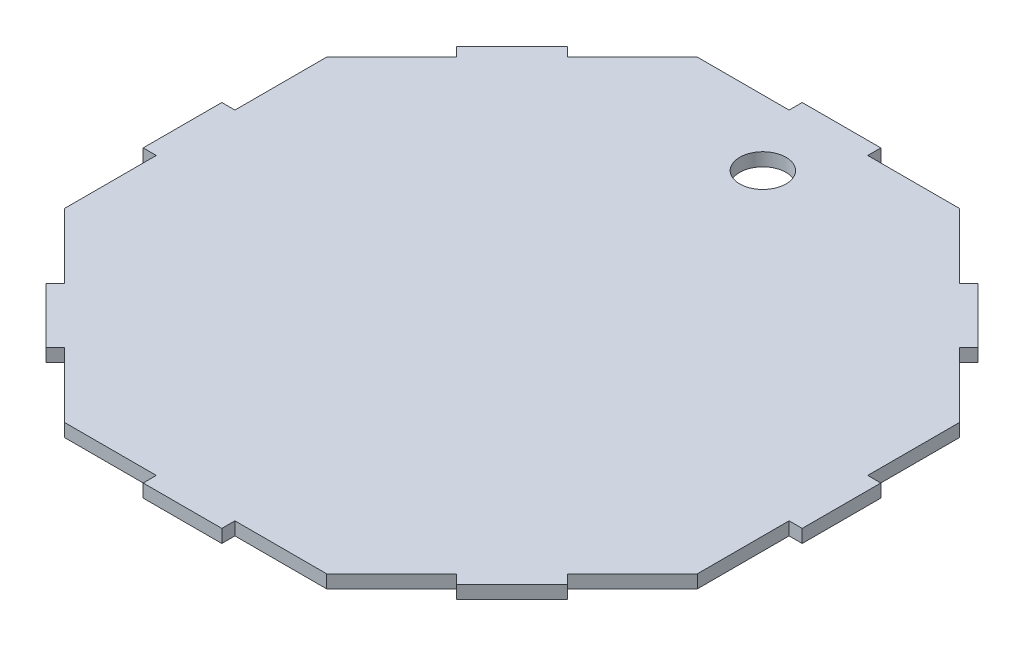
SolidWorks part; units mm, degrees
ref_plane "Alzado" through (0, 0, 0) normal (0, 0, 1) x (1, 0, 0)
ref_plane "Planta" through (0, 0, 0) normal (0, 1, 0) x (1, 0, 0)
ref_plane "Vista lateral" through (0, 0, 0) normal (1, 0, 0) x (0, 0, -1)
sketch "Croquis1" plane through (0, 0, 0) normal (0, 1, 0) x (1, 0, 0)
  line L0 (-30.909, -85.6617) -> (-30.909, -50.6617)
  line L1 (-30.909, 14.3383) -> (-6.1602, 39.087)
  line L2 (39.8017, 85.049) -> (74.8017, 85.049)
  line L3 (139.8017, 85.049) -> (164.5504, 60.3002)
  line L4 (210.5124, 14.3383) -> (210.5124, -20.6617)
  line L5 (210.5124, -85.6617) -> (185.7636, -110.4105)
  line L6 (139.8017, -156.3724) -> (104.8017, -156.3724)
  line L7 (39.8017, -156.3724) -> (15.053, -131.6237)
  line L8 (320.5164, -110.9064) -> (350.5164, -110.9064)
  line L9 (285.5164, -130.9064) -> (385.5164, -130.9064)
  line L10 (285.5164, -130.9064) -> (285.5164, -10.9064)
  line L11 (285.5164, -10.9064) -> (385.5164, -10.9064)
  line L12 (385.5164, -130.9064) -> (385.5164, -10.9064)
  line L13 (350.5164, -110.9064) -> (350.5164, -105.9064)
  line L14 (350.5164, -105.9064) -> (320.5164, -105.9064)
  line L15 (320.5164, -105.9064) -> (320.5164, -110.9064)
  line L16 (-35.909, -50.6617) -> (-35.909, -20.6617)
  line L17 (320.5164, -35.9064) -> (320.5164, -30.9064)
  line L18 (350.5164, -35.9064) -> (320.5164, -35.9064)
  line L19 (350.5164, -30.9064) -> (350.5164, -35.9064)
  line L20 (320.5164, -30.9064) -> (350.5164, -30.9064)
  line L21 (-9.6958, 42.6225) -> (11.5174, 63.8358)
  line L22 (74.8017, 90.049) -> (104.8017, 90.049)
  line L23 (168.086, 63.8358) -> (189.2992, 42.6225)
  line L24 (189.2992, -113.946) -> (168.086, -135.1592)
  line L25 (104.8017, -161.3724) -> (74.8017, -161.3724)
  line L26 (11.5174, -135.1592) -> (-9.6958, -113.946)
  line L27 (215.5124, -20.6617) -> (215.5124, -50.6617)
  line L28 (15.053, 60.3002) -> (39.8017, 85.049)
  line L29 (-30.909, -85.6617) -> (-23.8379, -85.6617)
  line L30 (-35.909, 16.4093) -> (37.7306, 90.049) construction
  line L31 (37.7306, 90.049) -> (141.8728, 90.049) construction
  line L32 (-30.909, -20.6617) -> (-30.909, 14.3383)
  line L33 (164.5504, -131.6237) -> (139.8017, -156.3724)
  line L34 (-30.909, 14.3383) -> (39.8017, 85.049) construction
  line L35 (139.8017, -156.3724) -> (139.292, -155.9055)
  line L36 (-35.909, -85.6617) -> (-35.909, 16.4093) construction
  line L37 (104.8017, 85.049) -> (139.8017, 85.049)
  line L38 (189.2992, -113.946) -> (185.7636, -110.4105)
  line L39 (-9.6958, 42.6225) -> (-6.1602, 39.087)
  line L40 (210.5124, -50.6617) -> (210.5124, -85.6617)
  line L41 (168.086, 63.8358) -> (164.5504, 60.3002)
  line L42 (-35.909, -50.6617) -> (-30.909, -50.6617)
  line L43 (189.2992, 42.6225) -> (185.7636, 39.087)
  line L44 (-35.909, -20.6617) -> (-30.909, -20.6617)
  line L45 (-30.909, -85.6617) -> (-30.909, 14.3383) construction
  line L46 (185.7636, 39.087) -> (210.5124, 14.3383)
  line L47 (39.8017, 85.049) -> (139.8017, 85.049) construction
  line L48 (141.8728, 90.049) -> (214.0479, 17.8738) construction
  line L49 (-30.909, -50.6617) -> (210.5124, -50.6617) construction
  line L50 (-6.1602, -110.4105) -> (-30.909, -85.6617)
  line L51 (15.053, 60.3002) -> (11.5174, 63.8358)
  line L52 (139.8017, 85.049) -> (210.5124, 14.3383) construction
  line L53 (-23.8379, -85.6617) -> (-30.909, -85.6617)
  line L54 (215.5124, 14.3383) -> (215.5124, -85.6617) construction
  line L55 (210.5124, 14.3383) -> (210.5124, -85.6617) construction
  line L56 (214.0479, -89.1973) -> (141.8728, -161.3724) construction
  line L57 (210.5124, -85.6617) -> (139.8017, -156.3724) construction
  line L58 (37.7306, -161.3724) -> (-34.4445, -89.1973) construction
  line L59 (74.8017, -156.3724) -> (39.8017, -156.3724)
  line L60 (-6.1602, -110.4105) -> (-9.6958, -113.946)
  line L61 (-30.909, -85.6617) -> (210.5124, -85.6617) construction
  line L62 (15.053, -131.6237) -> (11.5174, -135.1592)
  line L63 (164.5504, -131.6237) -> (168.086, -135.1592)
  line L64 (39.8017, -156.3724) -> (-30.909, -85.6617) construction
  line L65 (141.8728, -161.3724) -> (37.7306, -161.3724) construction
  line L67 (210.5124, -50.6617) -> (215.5124, -50.6617)
  line L68 (139.8017, -156.3724) -> (39.8017, -156.3724) construction
  line L69 (210.5124, -20.6617) -> (215.5124, -20.6617)
  line L73 (74.8017, -161.3724) -> (74.8017, -156.3724)
  line L74 (104.8017, 90.049) -> (104.8017, 85.049)
  line L77 (74.8017, 85.049) -> (74.8017, 90.049)
  line L79 (104.8017, -156.3724) -> (104.8017, -161.3724)
  circle A0 centre (89.8017, 60.049) radius 8.8281
  point P37 (210.5124, -20.6617)
  point P43 (185.7636, -110.4105)
  dimension "D1" = 135
  dimension "D2" = 135
  dimension "D3" = 135
  dimension "D4" = 135
  dimension "D5" = 30
  dimension "D6" = 135
  dimension "D7" = 135
  dimension "D8" = 100
  dimension "D9" = 100
  dimension "D10" = 100
  dimension "D11" = 100
  dimension "D12" = 5
  dimension "D13" = 100
  dimension "D14" = 100
  dimension "D15" = 5
  dimension "D16" = 120
  dimension "D17" = 35
  dimension "D18" = 35
  dimension "D19" = 20
  dimension "D20" = 5
  dimension "D21" = 5
  dimension "D22" = 35
extrude "Saliente-Extruir1" add sketch "Croquis1" along normal blind 5
